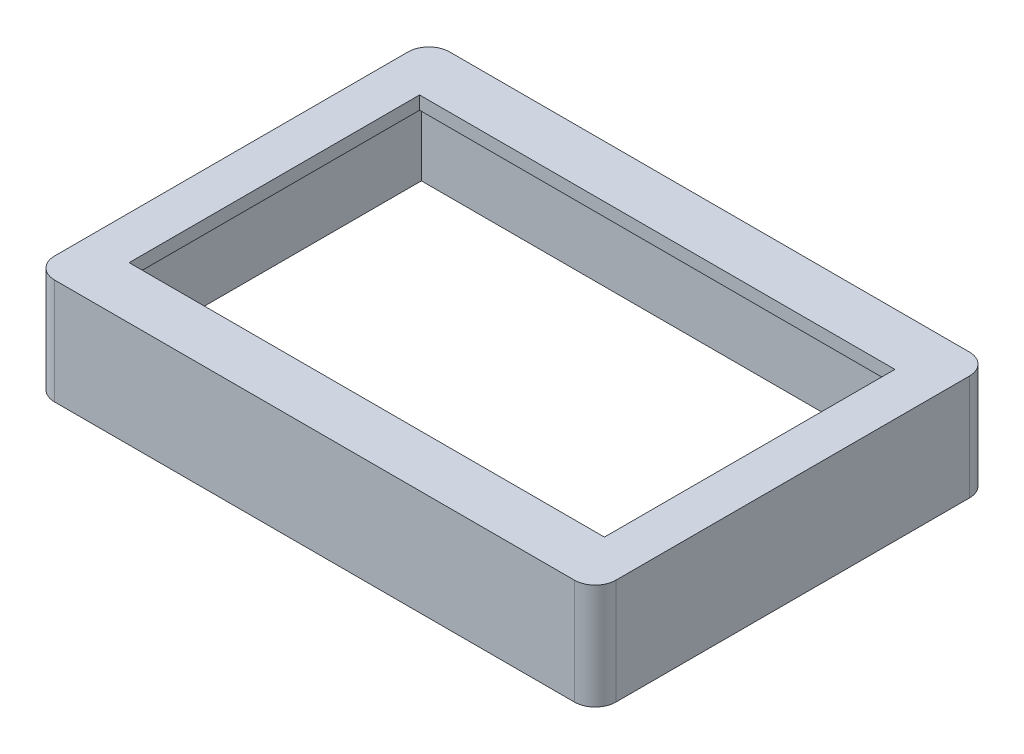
SolidWorks part; units mm, degrees
other "Markup1"
sketch "Sketch5" plane through (127, 25.4, -88.9) normal (0.0483, 0.9975, -0.051) x (0.9985, -0.0497, -0.025)
ref_plane "Front Plane" through (0, 0, 0) normal (0, 0, 1) x (1, 0, 0)
ref_plane "Top Plane" through (0, 0, 0) normal (0, 1, 0) x (1, 0, 0)
ref_plane "Right Plane" through (0, 0, 0) normal (1, 0, 0) x (0, 0, -1)
sketch "Sketch1" plane through (0, 0, 0) normal (0, 1, 0) x (1, 0, 0)
  line L1 (0, 0) -> (135, 0)
  line L2 (0, 0) -> (0, 95)
  line L3 (0, 95) -> (135, 95)
  line L4 (135, 0) -> (135, 95)
  dimension "D1" = 135
  dimension "D2" = 95
extrude "Boss-Extrude1" add sketch "Sketch1" along normal blind 25.4
sketch "Sketch2" plane through (0, 0, 0) normal (0, -1, 0) x (1, 0, 0)
  line L1 (124.65, -82.425) -> (10.35, -82.425)
  line L2 (124.65, -82.425) -> (124.65, -12.575)
  line L3 (124.65, -12.575) -> (10.35, -12.575)
  line L4 (10.35, -82.425) -> (10.35, -12.575)
  line L6 (0, -95) -> (0, 0) construction
  line L7 (0, 0) -> (135, 0) construction
  dimension "D1" = 114.3
  dimension "D2" = 69.85
  dimension "D3" = 10.35
  dimension "D4" = 12.575
extrude "Cut-Extrude1" cut sketch "Sketch2" against normal through all
sketch "Sketch4" plane through (0, 0, 0) normal (0, -1, 0) x (1, 0, 0)
  line L1 (131.5, -90.1467) -> (3.0638, -90.1467)
  line L2 (131.5, -90.1467) -> (131.5, -4.7467)
  line L3 (131.5, -4.7467) -> (3.0638, -4.7467)
  line L4 (3.0638, -90.1467) -> (3.0638, -4.7467)
  line L5 (135, -95) -> (0, -95) construction
  dimension "D1" = 128.4362
  dimension "D2" = 85.4
  dimension "D3" = 4.8533
extrude "Cut-Extrude2" cut sketch "Sketch4" against normal blind 22.225
fillet "Fillet1" radius 5 4 edges at (135, 12.7, -95) (135, 12.7, 0) (0, 12.7, 0) (0, 12.7, -95)
